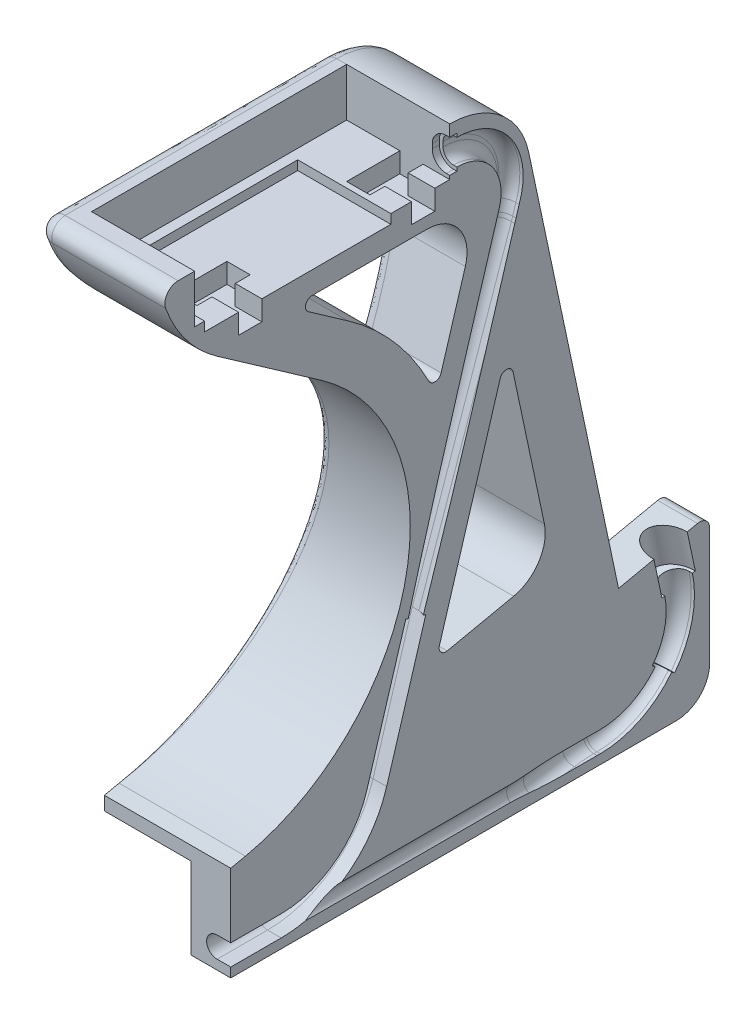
SolidWorks part; units mm, degrees
ref_plane "Front Plane" through (0, 0, 0) normal (0, 0, 1) x (1, 0, 0)
ref_plane "Top Plane" through (0, 0, 0) normal (0, 1, 0) x (1, 0, 0)
ref_plane "Right Plane" through (0, 0, 0) normal (1, 0, 0) x (0, 0, -1)
body saved out of another part "Stock-charging stand-1"
sketch "Sketch1" plane through (0, 0, 0) normal (1, 0, 0) x (0, 0, -1)
  line L2 (-26.2756, 85.1389) -> (-12.7642, 21.573) construction
  line L7 (-71.0701, 0) -> (-4.0701, 0) construction
  line L12 (-73.1491, 82.0055) -> (-57.4196, 70.9915) construction
  line L13 (-80.0701, 14.2914) -> (-80.0701, 0)
  line L15 (-70.0901, 94.75) -> (-38.1442, 94.75)
  line L16 (-26.2756, 85.1389) -> (-12.7642, 21.573)
  line L17 (-12.7642, 21.573) -> (-8.8026, 22.4151)
  line L18 (-12.7642, 21.573) -> (-0.882, 24.0986) construction
  line L19 (1.9299, 14.6858) -> (1.9299, 9.798)
  line L20 (0.9299, 22.6314) -> (0.9299, 5) construction
  line L21 (-61.1203, 0) -> (-9.02, 0)
  line L22 (0.9299, 22.6314) -> (0.9299, 5) construction
  line L26 (-73.1491, 82.0055) -> (-57.4196, 70.9915)
  line L28 (-78.9729, 92.75) -> (-80.6099, 93.899) construction
  arc A0 (-26.2756, 85.1389) -> (-38.1442, 94.75) centre (-38.1442, 82.6162) ccw construction
  arc A1 (-68.8598, 14.7612) -> (-57.4196, 70.9915) centre (-75.3645, 45.3636) ccw construction
  arc A2 (-80.8539, 92.0702) -> (-73.1491, 82.0055) centre (-61.104, 99.2077) ccw construction
  arc A3 (-78.9729, 94.75) -> (-80.8539, 92.0702) centre (-78.9729, 92.75) ccw construction
  arc A4 (-26.2756, 85.1389) -> (-38.1442, 94.75) centre (-38.1442, 82.6162) ccw
  arc A5 (-61.439, 17.3476) -> (-57.4196, 70.9915) centre (-75.3645, 45.3636) ccw
  arc A6 (-76.0795, 84.4858) -> (-73.1491, 82.0055) centre (-61.104, 99.2077) ccw
  arc A7 (-78.9729, 94.75) -> (-80.8539, 92.0702) centre (-78.9729, 92.75) ccw construction
  arc A8 (-71.0602, 95.5075) -> (-77.0925, 84.7387) centre (-79.7914, 93.3245) ccw
  arc A9 (2.7299, 15.6656) -> (-8.0165, 23.5023) centre (0.9299, 24.4838) ccw
  arc A10 (-62.8027, 17.8479) -> (-80.0701, 14.2914) centre (-71.0701, 14.2914) ccw
  arc A11 (-8.025, -0.9) -> (2.7299, 8.8182) centre (0.9299, 0) ccw
  arc A12 (-80.0701, 0) -> (-62.1153, -0.9) centre (-71.0701, 0) ccw
  arc A13 (-8.8026, 22.4151) -> (-8.0165, 23.5023) centre (-9.0105, 23.3932) ccw
  arc A14 (-77.0925, 84.7387) -> (-76.0795, 84.4858) centre (-76.7926, 83.7847) cw
  arc A15 (-71.0602, 95.5075) -> (-70.0901, 94.75) centre (-70.0901, 95.75) ccw
  arc A16 (1.9299, 9.798) -> (2.7299, 8.8182) centre (2.9299, 9.798) ccw
  arc A17 (1.9299, 14.6858) -> (2.7299, 15.6656) centre (2.9299, 14.6858) cw
  arc A18 (-61.439, 17.3476) -> (-62.8027, 17.8479) centre (-61.8841, 18.2431) cw
  arc A19 (-62.1153, -0.9) -> (-61.1203, 0) centre (-61.1203, -1) cw
  arc A20 (-8.025, -0.9) -> (-9.02, 0) centre (-9.02, -1) ccw
  dimension "D1" = 18
  dimension "D2" = 18
  dimension "D3" = 18
  dimension "D5" = 1
  dimension "D6" = 1
  dimension "D7" = 1
  dimension "D4" = 1
extrude "Base layer" [suppressed] add sketch "Sketch1" along normal blind 0.25
sketch "Sketch3" [suppressed] plane through (0, 0, 0) normal (-1, 0, 0) x (0, 0, 1)
  line L0 (78.9729, 92.75) -> (85.5209, 97.3461) construction
  line L1 (78.9729, 92.75) -> (86.4967, 90.031) construction
  line L2 (78.9729, 92.75) -> (78.9729, 100.75) construction
  line L3 (79.4729, 92.75) -> (79.4729, 100.75)
  line L4 (79.2602, 92.3408) -> (85.8082, 96.9368)
  line L5 (78.803, 92.2798) -> (86.3268, 89.5607)
  line L6 (78.4729, 92.75) -> (78.4729, 100.75)
  line L7 (78.6857, 93.1592) -> (85.2337, 97.7553)
  line L8 (79.1429, 93.2202) -> (86.6666, 90.5012)
  line L9 (79.4729, 92.75) -> (78.4729, 92.75)
  line L10 (79.4729, 100.75) -> (78.4729, 100.75)
  line L11 (79.2602, 92.3408) -> (78.6857, 93.1592)
  line L12 (85.8082, 96.9368) -> (85.2337, 97.7553)
  line L13 (78.803, 92.2798) -> (79.1429, 93.2202)
  line L14 (86.3268, 89.5607) -> (86.6666, 90.5012)
  line L15 (70.5701, 13.7914) -> (75.5199, 18.7412) construction
  line L16 (70.9237, 13.4379) -> (75.8734, 18.3876)
  line L17 (70.2166, 14.145) -> (75.1663, 19.0947)
  line L18 (70.9237, 13.4379) -> (70.2166, 14.145)
  line L19 (75.8734, 18.3876) -> (75.1663, 19.0947)
  line L20 (0.5701, 22.6314) -> (0.5701, 31.6314) construction
  line L21 (0.5701, 22.6314) -> (-8.4299, 22.6314) construction
  line L22 (4.0701, 0) -> (71.0701, 0) construction
  line L23 (0.5701, 22.6314) -> (-5.7938, 28.9954) construction
  line L24 (70.5701, 13.7914) -> (77.5701, 13.7914) construction
  line L25 (70.5701, 13.7914) -> (70.5701, 20.7914) construction
  line L26 (70.5701, 13.7914) -> (75.5199, 18.7412) construction
  line L27 (1.0701, 22.6314) -> (1.0701, 31.6314)
  line L28 (0.9237, 22.985) -> (-5.4403, 29.3489)
  line L29 (0.5701, 23.1314) -> (-8.4299, 23.1314)
  line L30 (71.0701, 13.7914) -> (71.0701, 20.7914)
  line L31 (70.5701, 13.2914) -> (77.5701, 13.2914)
  line L32 (0.0701, 22.6314) -> (0.0701, 31.6314)
  line L33 (0.2166, 22.2779) -> (-6.1474, 28.6418)
  line L34 (0.5701, 22.1314) -> (-8.4299, 22.1314)
  line L35 (70.0701, 13.7914) -> (70.0701, 20.7914)
  line L36 (70.5701, 14.2914) -> (77.5701, 14.2914)
  line L37 (1.0701, 22.6314) -> (0.0701, 22.6314)
  line L38 (1.0701, 31.6314) -> (0.0701, 31.6314)
  line L39 (0.9237, 22.985) -> (0.2166, 22.2779)
  line L40 (-5.4403, 29.3489) -> (-6.1474, 28.6418)
  line L41 (0.5701, 23.1314) -> (0.5701, 22.1314)
  line L42 (-8.4299, 23.1314) -> (-8.4299, 22.1314)
  line L43 (71.0701, 13.7914) -> (70.0701, 13.7914)
  line L44 (71.0701, 20.7914) -> (70.0701, 20.7914)
  line L45 (70.5701, 13.2914) -> (70.5701, 14.2914)
  line L46 (77.5701, 13.2914) -> (77.5701, 14.2914)
  line L47 (2.3024, 3.2322) -> (-4.0616, -3.1317) construction
  line L48 (2.3024, 3.2322) -> (2.3024, -5.7678) construction
  line L49 (2.3024, 3.2322) -> (-6.6976, 3.2322) construction
  line L50 (2.3024, 3.7322) -> (-6.6976, 3.7322)
  line L51 (1.9488, 3.5858) -> (-4.4151, -2.7782)
  line L52 (1.8024, 3.2322) -> (1.8024, -5.7678)
  line L53 (2.3024, 2.7322) -> (-6.6976, 2.7322)
  line L54 (2.6559, 2.8787) -> (-3.708, -3.4853)
  line L55 (2.8024, 3.2322) -> (2.8024, -5.7678)
  line L56 (2.3024, 3.7322) -> (2.3024, 2.7322)
  line L57 (-6.6976, 3.7322) -> (-6.6976, 2.7322)
  line L58 (1.9488, 3.5858) -> (2.6559, 2.8787)
  line L59 (-4.4151, -2.7782) -> (-3.708, -3.4853)
  line L60 (1.8024, 3.2322) -> (2.8024, 3.2322)
  line L61 (1.8024, -5.7678) -> (2.8024, -5.7678)
  line L62 (70.5701, 0.5) -> (76.0199, -4.9497) construction
  line L63 (70.5701, 0.5) -> (78.0701, 0.5) construction
  line L64 (70.5701, 0.5) -> (70.5701, -7) construction
  line L65 (70.5701, 0) -> (78.0701, 0)
  line L66 (70.2166, 0.1464) -> (75.6663, -5.3033)
  line L67 (70.0701, 0.5) -> (70.0701, -7)
  line L68 (70.5701, 1) -> (78.0701, 1)
  line L69 (70.9237, 0.8536) -> (76.3734, -4.5962)
  line L70 (71.0701, 0.5) -> (71.0701, -7)
  line L71 (70.5701, 0) -> (70.5701, 1)
  line L72 (78.0701, 0) -> (78.0701, 1)
  line L73 (70.2166, 0.1464) -> (70.9237, 0.8536)
  line L74 (75.6663, -5.3033) -> (76.3734, -4.5962)
  line L75 (70.0701, 0.5) -> (71.0701, 0.5)
  line L76 (70.0701, -7) -> (71.0701, -7)
  line L77 (71.0701, 0) -> (71.0701, 12.2467) construction
  line L78 (4.0701, 5) -> (0.5346, 1.4645) construction
  arc A0 (80.8539, 92.0702) -> (78.9729, 94.75) centre (78.9729, 92.75) ccw construction
  arc A4 (76.0795, 84.4858) -> (80.8539, 92.0702) centre (61.104, 99.2077) ccw construction
  arc A6 (76.0795, 84.4858) -> (80.8539, 92.0702) centre (61.104, 99.2077) ccw
  arc A7 (-0.9299, 5) -> (4.0701, 0) centre (4.0701, 5) ccw construction
  arc A8 (-0.9299, 5) -> (4.0701, 0) centre (4.0701, 5) ccw
  arc A10 (0.882, 24.0986) -> (-0.9299, 22.6314) centre (0.5701, 22.6314) ccw construction
  arc A11 (0.882, 24.0986) -> (-0.9299, 22.6314) centre (0.5701, 22.6314) ccw
  point P8 (80.6099, 93.899)
  dimension "D1" = 8
  dimension "D6" = 0.5
  dimension "D12" = 45
  dimension "D13" = 0.5
  dimension "D14" = 7
  dimension "D15" = 7
  dimension "D16" = 45
  dimension "D17" = 7
  dimension "D18" = 0.5
  dimension "D19" = 45
  dimension "D20" = 7
  dimension "D21" = 7
  dimension "D22" = 7
  dimension "D25" = 45
  dimension "D26" = 9
  dimension "D27" = 9
  dimension "D28" = 9
  dimension "D29" = 9
  dimension "D30" = 0.5
  dimension "D31" = 0.5
  dimension "D32" = 1
  dimension "D2" = 0.5
  dimension "D3" = 0.5
  dimension "D4" = 0.5
  dimension "D5" = 0.5
  dimension "D8" = 0.5
  dimension "D9" = 0.5
  dimension "D10" = 0.5
  dimension "D11" = 0.5
extrude "Anchors" [suppressed] add sketch "Sketch3" along normal blind 3
chamfer "Chamfer1" [suppressed] distance 3 angle 45
